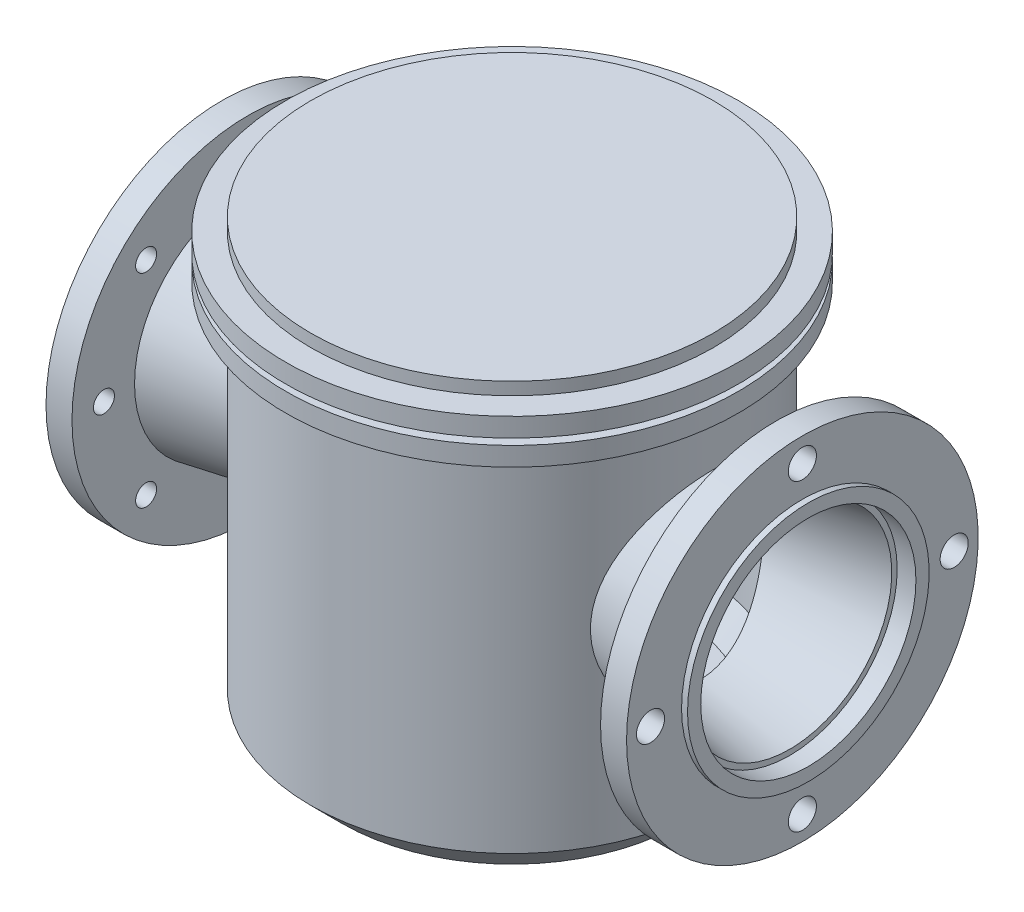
SolidWorks part; units mm, degrees
ref_plane "Front" through (0, 0, 0) normal (0, 0, 1) x (1, 0, 0)
ref_plane "Top" through (0, 0, 0) normal (0, 1, 0) x (1, 0, 0)
ref_plane "Right" through (0, 0, 0) normal (1, 0, 0) x (0, 0, -1)
sketch "Sketch1" plane through (0, 0, 0) normal (0, 0, 1) x (1, 0, 0)
  line L0 (0, -64.0794) -> (0, 96.1191) construction
  line L1 (0, -185) -> (50, -185)
  line L2 (50, -185) -> (50, -175)
  line L3 (50, -175) -> (135, -175)
  line L4 (135, -175) -> (160, -150)
  line L5 (160, -150) -> (160, 175)
  line L6 (160, 175) -> (0, 175)
  line L8 (0, 0) -> (119.9736, 0) construction
  line L15 (0, -185) -> (0, 175)
  dimension "D1" = 160
  dimension "D2" = 175
  dimension "D3" = 175
  dimension "D4" = 25
  dimension "D5" = 135
  dimension "D6" = 50
  dimension "D7" = 10
revolve "Base-Revolve" add sketch "Sketch1" angle 360 about L0
sketch "Sketch2" plane through (0, 0, 0) normal (0, 0, 1) x (1, 0, 0)
  line L0 (160, -150) -> (160, 175) construction
  line L1 (160, 165) -> (180, 165)
  line L2 (160, 165) -> (160, 150)
  line L3 (160, 150) -> (180, 150)
  line L4 (180, 165) -> (180, 150)
  line L5 (160, 145) -> (180, 145)
  line L6 (160, 145) -> (160, 130)
  line L7 (160, 130) -> (180, 130)
  line L8 (180, 145) -> (180, 130)
  line L9 (160, 175) -> (-160, 175) construction
  line L10 (0, 0) -> (0, 185.8464) construction
  dimension "D1" = 15
  dimension "D2" = 5
  dimension "D3" = 20
  dimension "D4" = 10
revolve "Boss-Revolve1" add sketch "Sketch2" angle 360 about L10
sketch "Sketch3" plane through (0, 0, 0) normal (0, 0, 1) x (1, 0, 0)
  line L0 (0, 0) -> (283.0144, 0) construction
  line L1 (0, 0) -> (0, 52.9713)
  line L2 (0, -64.0794) -> (0, 96.1191) construction
  line L3 (0, 52.9713) -> (210, 90)
  line L4 (210, 90) -> (210, 139.7)
  line L5 (210, 139.7) -> (230.65, 139.7)
  line L6 (230.65, 139.7) -> (230.65, 96)
  line L7 (230.65, 96) -> (235.4, 96)
  line L8 (235.4, 96) -> (235.4, 0)
  line L9 (235.4, 0) -> (0, 0)
  dimension "D1" = 210
  dimension "D2" = 96
  dimension "D3" = 4.75
  dimension "D4" = 20.65
  dimension "D5" = 139.7
  dimension "D6" = 90
  dimension "D7" = 100
revolve "Boss-Revolve2" add sketch "Sketch3" angle 360 about L0
mirror "Mirror1" about plane through (0, 0, 0) normal (1, 0, 0) of "Boss-Revolve2"
shell "Shell1" thickness 10.5
sketch "Sketch8" plane through (-235.4, 0, 0) normal (-1, 0, 0) x (0, 0, 1)
  circle A0 centre (0, 0) radius 81.1911
  dimension "D1" = 162.3822
extrude "Cut-Extrude3" [suppressed] cut sketch "Sketch8" against normal through all
sketch "Sketch5" plane through (230.65, 0, 0) normal (1, 0, 0) x (0, 0, -1)
  line L1 (0, 0) -> (0, 158.3439) construction
  line L2 (0, 0) -> (0, 120.65) construction
  circle A0 centre (0, 120.65) radius 11.175
  dimension "D1" = 22.35
  dimension "D2" = 120.65
  dimension "D3" = 0
extrude "Cut-Extrude1" cut sketch "Sketch5" against normal up to next
pattern_circular "CirPattern1" count 4 over 360 about axis through (0, 0, 0) along (1, 0, 0) of "Cut-Extrude1"
sketch "Sketch6" plane through (-230.65, 0, 0) normal (-1, 0, 0) x (0, 0, 1)
  circle A0 centre (0, 120.65) radius 11.175 construction
  circle A1 centre (0, 120.65) radius 11.175
extrude "Cut-Extrude2" [suppressed] cut sketch "Sketch6" against normal up to next
pattern_circular "CirPattern3" [suppressed] count 4 over 360
sketch "Sketch7" [suppressed] plane through (0, 0, 0) normal (0, 0, 1) x (1, 0, 0)
  line L0 (0, 0) -> (0, 290.4191) construction
  line L1 (0, 164.5) -> (0, -145.6508) construction
  line L2 (-18.5, 175) -> (18.5, 175)
  line L3 (18.5, 175) -> (18.5, 193.1848)
  line L4 (-18.5, 175) -> (-18.5, 193.1848)
  line L5 (160, 175) -> (-160, 175) construction
  arc A0 (-18.5, 193.1848) -> (18.5, 193.1848) centre (0, 210) cw
  circle A1 centre (0, 210) radius 15
  point P8 (0, 175)
  dimension "D1" = 25
  dimension "D2" = 30
  dimension "D3" = 37
  dimension "D4" = 35
extrude "Boss-Extrude1" [suppressed] add sketch "Sketch7" along normal mid plane 10
sketch "Sketch15" plane through (-230.65, 0, 0) normal (-1, 0, 0) x (0, 0, 1)
  circle A0 centre (0, 0) radius 96 construction
  circle A1 centre (0, 0) radius 96
extrude "Cut-Extrude4" cut sketch "Sketch15" along normal up to surface (4.75 mm away)
sketch "Sketch9" [suppressed] plane through (-230.65, 0, 0) normal (-1, 0, 0) x (0, 0, 1)
  circle A0 centre (-111.4661, 46.1708) radius 12.7
  dimension "D1" = 25.4
sketch "Sketch13" [suppressed] plane through (0, 164.5, 0) normal (0, -1, 0) x (1, 0, 0)
  circle A0 centre (0, 0) radius 149.5 construction
  circle A1 centre (0, 0) radius 149.5
sketch "Sketch14" plane through (0, -174.5, 0) normal (0, 1, 0) x (1, 0, 0)
  circle A0 centre (0, 0) radius 39.5 construction
  circle A1 centre (0, 0) radius 39.5
extrude "Extrude2" add sketch "Sketch14" along normal up to surface (10 mm away)
hole_wizard "5/8 Clearance Hole2" positions "Sketch18" profile "Sketch19" hole size "5/8" standard "Ansi Inch"
sketch "Sketch18" plane through (-230.65, -86.9453, 61.2299) normal (-1, 0, 0) x (0, 0, 1)
  line L0 (-61.2299, 86.9453) -> (-61.2299, 353.2126) construction
  line L1 (-61.2299, 86.9453) -> (208.6165, 86.9453) construction
  line L2 (-61.2299, 86.9453) -> (-335.3638, 86.9453) construction
  line L3 (-61.2299, 86.9453) -> (-61.2299, -193.2291) construction
  line L7 (-61.2299, 86.9453) -> (113.4341, 261.6093) construction
  line L8 (-61.2299, 86.9453) -> (150.6399, -124.9245) construction
  line L9 (-61.2299, 86.9453) -> (-186.2909, 212.0063) construction
  line L10 (-61.2299, 86.9453) -> (-176.5965, -28.4213) construction
  circle A0 centre (-61.2299, 86.9453) radius 114.3 construction
  point P0 (-61.2299, 201.2453)
  point P1 (-176.5965, 86.9453)
  point P2 (-142.0522, 167.7676)
  point P3 (19.5924, 167.7676)
  point P4 (53.0701, 86.9453)
  point P5 (19.5924, 6.123)
  point P6 (-61.2299, -27.4065)
  point P7 (-142.0522, 6.123)
sketch "Sketch19" plane through (-230.65, 114.3, 0) normal (0, 1, 0) x (0, 0, 1)
  line L0 (0, 0) -> (0, 20.65)
  line L1 (0, 20.65) -> (8.3337, 20.65)
  line L2 (8.3337, 20.65) -> (8.3337, 0)
  line L3 (8.3337, 0) -> (0, 0)
  line L4 (0, -6.35) -> (0, 107.95) construction
  dimension "Thru Hole Dia." = 16.6675
  dimension "Thru Hole Depth" = 20.65
hole_wizard "5/8 Clearance Hole3" positions "Sketch20" profile "Sketch21" hole size "5/8" standard "Ansi Inch"
sketch "Sketch20" plane through (-230.65, -86.9453, 61.2299) normal (-1, 0, 0) x (0, 0, 1)
  point P0 (-64.3378, 197.2771)
  point P1 (39.851, 49.4978)
  point P2 (-73.6499, -26.8437)
  point P3 (-171.7422, 70.605)
sketch "Sketch21" plane through (-230.65, 110.3318, -3.1079) normal (0, 1, 0) x (0, 0, 1)
  line L0 (0, 0) -> (0, 20.65)
  line L1 (0, 20.65) -> (8.3337, 20.65)
  line L2 (8.3337, 20.65) -> (8.3337, 0)
  line L3 (8.3337, 0) -> (0, 0)
  line L4 (0, -6.35) -> (0, 107.95) construction
  dimension "Thru Hole Dia." = 16.6675
  dimension "Thru Hole Depth" = 20.65
